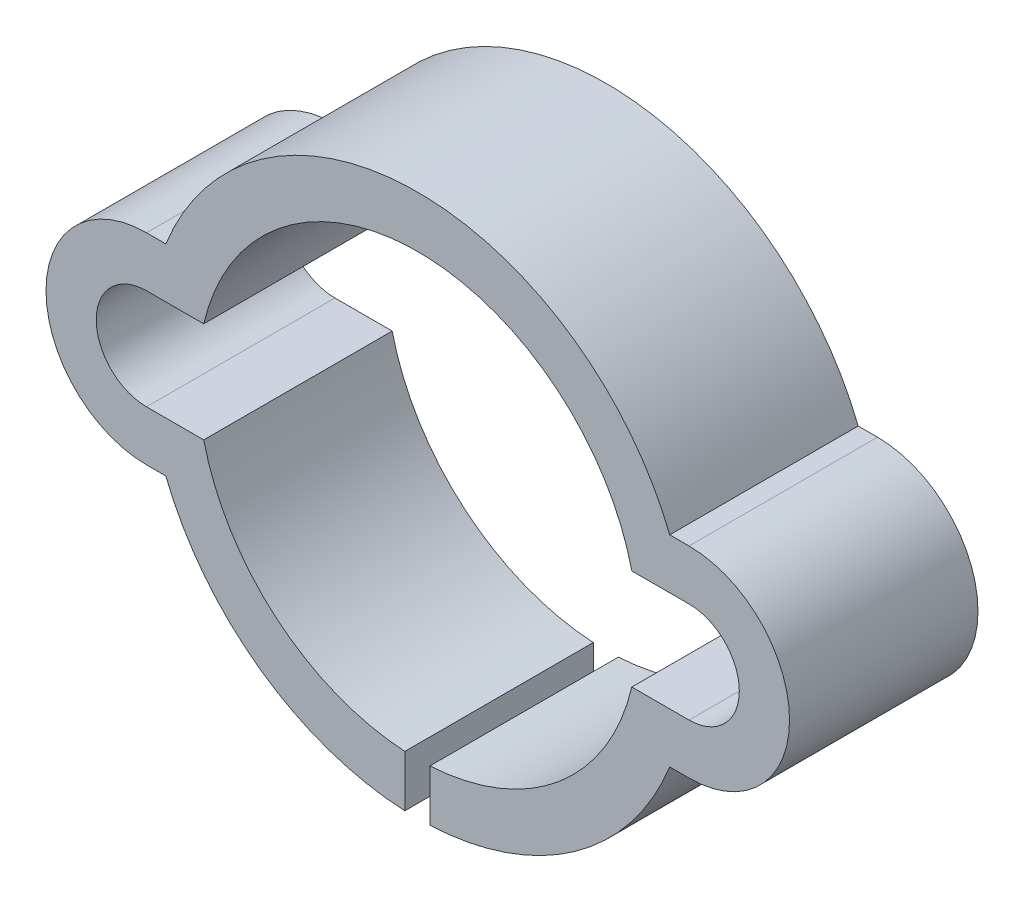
SolidWorks part; units mm, degrees
ref_plane "Front Plane" through (0, 0, 0) normal (0, 0, 1) x (1, 0, 0)
ref_plane "Top Plane" through (0, 0, 0) normal (0, 1, 0) x (1, 0, 0)
ref_plane "Right Plane" through (0, 0, 0) normal (1, 0, 0) x (0, 0, -1)
sketch "Sketch1" plane through (0, 0, 0) normal (0, 0, 1) x (1, 0, 0)
  line L0 (0, 0) -> (0, 2.9873) construction
  line L1 (-4.3184, 0.8) -> (-3.4073, 0.8)
  line L3 (-4.3184, -0.8) -> (-3.4073, -0.8)
  line L5 (-4.3184, 1.6) -> (-4.011, 1.6)
  line L6 (-4.3184, -1.6) -> (-4.011, -1.6)
  line L7 (4.011, 1.6) -> (4.3184, 1.6)
  line L8 (-4.3184, 1.6) -> (4.3184, 1.6) construction
  line L9 (3.4073, 0.8) -> (4.3184, 0.8)
  line L10 (-4.3184, 0.8) -> (4.3184, 0.8) construction
  line L11 (3.4073, -0.8) -> (4.3184, -0.8)
  line L12 (-4.3184, -0.8) -> (4.3184, -0.8) construction
  line L13 (4.011, -1.6) -> (4.3184, -1.6)
  line L14 (-4.3184, -1.6) -> (4.3184, -1.6) construction
  line L20 (-0.2059, -3.4939) -> (-0.2059, -4.3135)
  line L22 (0.1932, -3.4947) -> (0.1932, -4.3141)
  arc A7 (-3.4073, -0.8) -> (-0.2059, -3.4939) centre (0, 0) ccw
  arc A9 (-4.3184, 0.8) -> (-4.3184, -0.8) centre (-4.3184, 0) ccw
  arc A10 (4.3184, -0.8) -> (4.3184, 0.8) centre (4.3184, 0) ccw
  arc A12 (-4.3184, 1.6) -> (-4.3184, -1.6) centre (-4.3184, 0) ccw
  arc A13 (4.3184, -1.6) -> (4.3184, 1.6) centre (4.3184, 0) ccw
  arc A14 (3.4073, 0.8) -> (-3.4073, 0.8) centre (0, 0) ccw
  arc A16 (4.1702, -1.5931) -> (4.1702, 1.5931) centre (4.3184, 0) ccw construction
  arc A17 (4.011, 1.6) -> (-4.011, 1.6) centre (0, 0) ccw
  arc A18 (-4.1702, 1.5931) -> (-4.1702, -1.5931) centre (-4.3184, 0) ccw construction
  arc A19 (-4.011, -1.6) -> (-0.2059, -4.3135) centre (0, 0) ccw
  arc A20 (4.2443, -0.7966) -> (4.2443, 0.7966) centre (4.3184, 0) ccw construction
  arc A21 (-4.2443, 0.7966) -> (-4.2443, -0.7966) centre (-4.3184, 0) ccw construction
  arc A22 (0.1932, -3.4947) -> (3.4073, -0.8) centre (0, 0) ccw
  arc A23 (0.1932, -4.3141) -> (4.011, -1.6) centre (0, 0) ccw
extrude "Boss-Extrude1" add sketch "Sketch1" along normal blind 3
